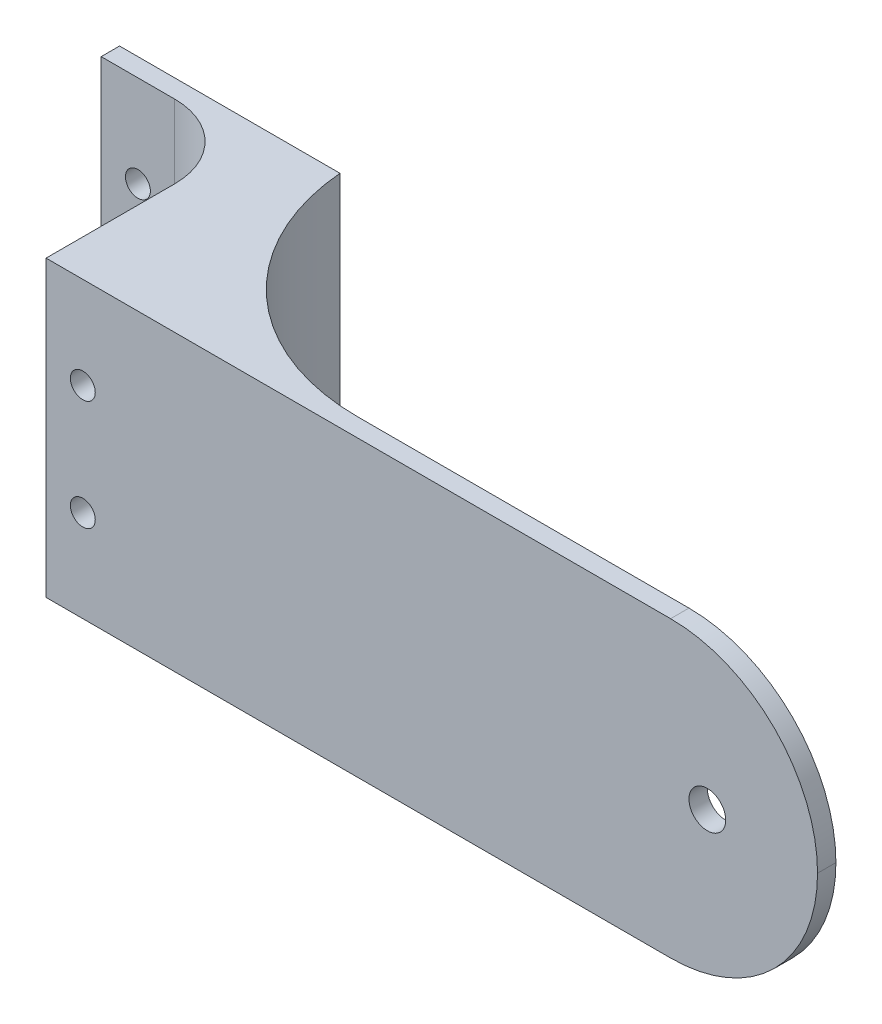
SolidWorks part; units mm, degrees
ref_plane "Front Plane" through (0, 0, 0) normal (0, 0, 1) x (1, 0, 0)
ref_plane "Top Plane" through (0, 0, 0) normal (0, 1, 0) x (1, 0, 0)
ref_plane "Right Plane" through (0, 0, 0) normal (1, 0, 0) x (0, 0, -1)
ref_plane "Plane1" through (0, 0, 15.875) normal (0, 0, 1) x (1, 0, 0)
sketch "Sketch1" plane through (0, 0, 15.875) normal (0, 0, 1) x (1, 0, 0)
  line L0 (0, -25.4) -> (0, 25.4) construction
  line L1 (0, 25.4) -> (-38.1, 25.4) construction
  line L2 (-38.1, 25.4) -> (-38.1, -25.4)
  line L3 (-38.1, -25.4) -> (-25.4, -25.4)
  line L5 (0, 25.4) -> (-38.1, 25.4)
  line L6 (-25.4, -25.4) -> (0, -25.4)
  line L7 (0, -25.4) -> (0, 25.4)
  point P2 (0, 0)
  dimension "D1" = 50.8
  dimension "D2" = 38.1
  dimension "D3" = 12.7
extrude "Boss-Extrude1" add sketch "Sketch1" along normal blind 3.175
ref_plane "Plane2" through (0, 0, 50.8) normal (0, 0, 1) x (1, 0, 0)
sketch "Sketch2" plane through (0, 0, 50.8) normal (0, 0, 1) x (1, 0, 0)
  line L0 (0, -25.4) -> (0, 25.4) construction
  line L1 (0, 25.4) -> (-12.7, 25.4)
  line L2 (-12.7, 25.4) -> (-12.7, -25.4)
  line L3 (-12.7, -25.4) -> (0, -25.4)
  line L4 (0, -25.4) -> (0, 25.4)
  point P2 (0, 0)
  dimension "D1" = 50.8
  dimension "D2" = 12.7
extrude "Boss-Extrude2" add sketch "Sketch2" against normal up to surface (31.75 mm away)
fillet "Fillet1" radius 12.7 1 edges at (-12.7, 0, 19.05)
sketch "Sketch3" plane through (0, 0, 50.8) normal (0, 0, 1) x (1, 0, 0)
  line L0 (0, 0) -> (0, 25.4) construction
  line L1 (0, -25.4) -> (0, 25.4) construction
  line L2 (0, 25.4) -> (101.6, 25.4)
  line L3 (101.6, 25.4) -> (120.65, 25.4)
  line L4 (120.65, 25.4) -> (120.65, -25.4)
  line L5 (120.65, -25.4) -> (0, -25.4)
  line L6 (0, -25.4) -> (-12.7, -25.4)
  line L7 (-12.7, -25.4) -> (-12.7, 25.4)
  line L8 (-12.7, 25.4) -> (0, 25.4)
  dimension "D1" = 19.05
  dimension "D2" = 101.6
  dimension "D3" = 50.8
  dimension "D4" = 12.7
extrude "Boss-Extrude3" add sketch "Sketch3" along normal blind 3.175
fillet "Fillet2" radius 38.1 1 edges at (0, 0, 50.8)
sketch "Sketch4" plane through (0, 0, 53.975) normal (0, 0, 1) x (1, 0, 0)
  line L0 (0, 0) -> (-55.8335, 0) construction
  line L1 (0, -25.4) -> (0, 25.4) construction
  line L2 (-38.1, 25.4) -> (-38.1, -25.4) construction
  line L3 (-38.1, 25.4) -> (-38.1, -25.4) construction
  line L7 (0, -25.4) -> (0, 25.4) construction
  line L8 (0, -25.4) -> (0, 25.4) construction
  circle A0 centre (-6.35, 9.525) radius 2.1527
  circle A2 centre (-31.75, 9.525) radius 2.1527
  circle A4 centre (-6.35, -9.525) radius 2.1527
  circle A5 centre (-31.75, -9.525) radius 2.1527
  dimension "D1" = 4.3053
  dimension "D2" = 6.35
  dimension "D3" = 9.525
  dimension "D4" = 19.05
  dimension "D5" = 25.4
  dimension "D6" = 38.1
extrude "Cut-Extrude1" cut sketch "Sketch4" against normal up to surface (38.1 mm away)
fillet "Fillet3" radius 25.4 2 edges at (120.65, -25.4, 52.3875) (120.65, 25.4, 52.3875)
sketch "Sketch5" plane through (0, 0, 53.975) normal (0, 0, 1) x (1, 0, 0)
  line L0 (0, -25.4) -> (0, 25.4) construction
  line L1 (0, -25.4) -> (0, 25.4) construction
  line L2 (95.25, 25.4) -> (-12.7, 25.4) construction
  line L3 (82.5851, -19.0149) -> (120.6149, 19.0149) construction
  line L4 (118.089, -16.489) -> (85.111, 16.489) construction
  line L5 (101.6, 0) -> (101.6, -34.636) construction
  circle A0 centre (101.6, 0) radius 3.175 construction
  circle A1 centre (101.6, 0) radius 9.525
  circle A2 centre (101.6, 0) radius 13 construction
  circle A4 centre (110.7924, 9.1924) radius 1.5875
  circle A5 centre (110.7924, -9.1924) radius 1.5875
  circle A6 centre (92.4076, -9.1924) radius 1.5875
  circle A7 centre (92.4076, 9.1924) radius 1.5875
  point P4 (0, 0)
  point P21 (101.6, 0)
  point P24 (101.6, 0)
  dimension "D2" = 6.35
  dimension "D3" = 19.05
  dimension "D4" = 26
  dimension "D5" = 3.175
  dimension "D1" = 101.6
  dimension "D6" = 25.4
  dimension "D7" = 45
  dimension "D8" = 90
extrude "Cut-Extrude2" [suppressed] cut sketch "Sketch5" against normal up to surface (3.175 mm away)
sketch "Sketch6" [suppressed] plane through (0, 0, 53.975) normal (0, 0, 1) x (1, 0, 0)
  line L0 (80.4908, -21.1092) -> (122.7092, 21.1092) construction
  line L1 (119.8449, -18.2449) -> (83.3551, 18.2449) construction
  line L2 (101.6, 0) -> (101.6, -31.1994) construction
  line L3 (95.25, 25.4) -> (-12.7, 25.4) construction
  circle A0 centre (101.6, 0) radius 8.55
  circle A1 centre (101.6, 0) radius 11 construction
  circle A2 centre (93.8218, 7.7782) radius 1.5875
  circle A3 centre (109.3782, 7.7782) radius 1.5875
  circle A4 centre (109.3782, -7.7782) radius 1.5875
  circle A5 centre (93.8218, -7.7782) radius 1.5875
  circle A6 centre (93.8218, 7.7782) radius 2.75 construction
  point P2 (0, 0)
  point P8 (101.6, 0)
  point P10 (101.6, 0)
  point P23 (95.7664, 5.8336)
  point P24 (95.5542, 6.0458)
  dimension "D2" = 17.1
  dimension "D3" = 22
  dimension "D6" = 3.175
  dimension "D8" = 5.5
  dimension "D1" = 101.6
  dimension "D4" = 45
  dimension "D5" = 45
  dimension "D7" = 25.4
extrude "Cut-Extrude3" [suppressed] cut sketch "Sketch6" against normal up to surface (3.175 mm away)
sketch "Sketch7" plane through (0, 0, 53.975) normal (0, 0, 1) x (1, 0, 0)
  line L0 (95.25, 25.4) -> (-12.7, 25.4) construction
  circle A0 centre (101.6, 0) radius 3.175
  point P2 (0, 0)
  dimension "D2" = 6.35
  dimension "D1" = 101.6
  dimension "D3" = 25.4
extrude "Cut-Extrude4" cut sketch "Sketch7" against normal up to next
